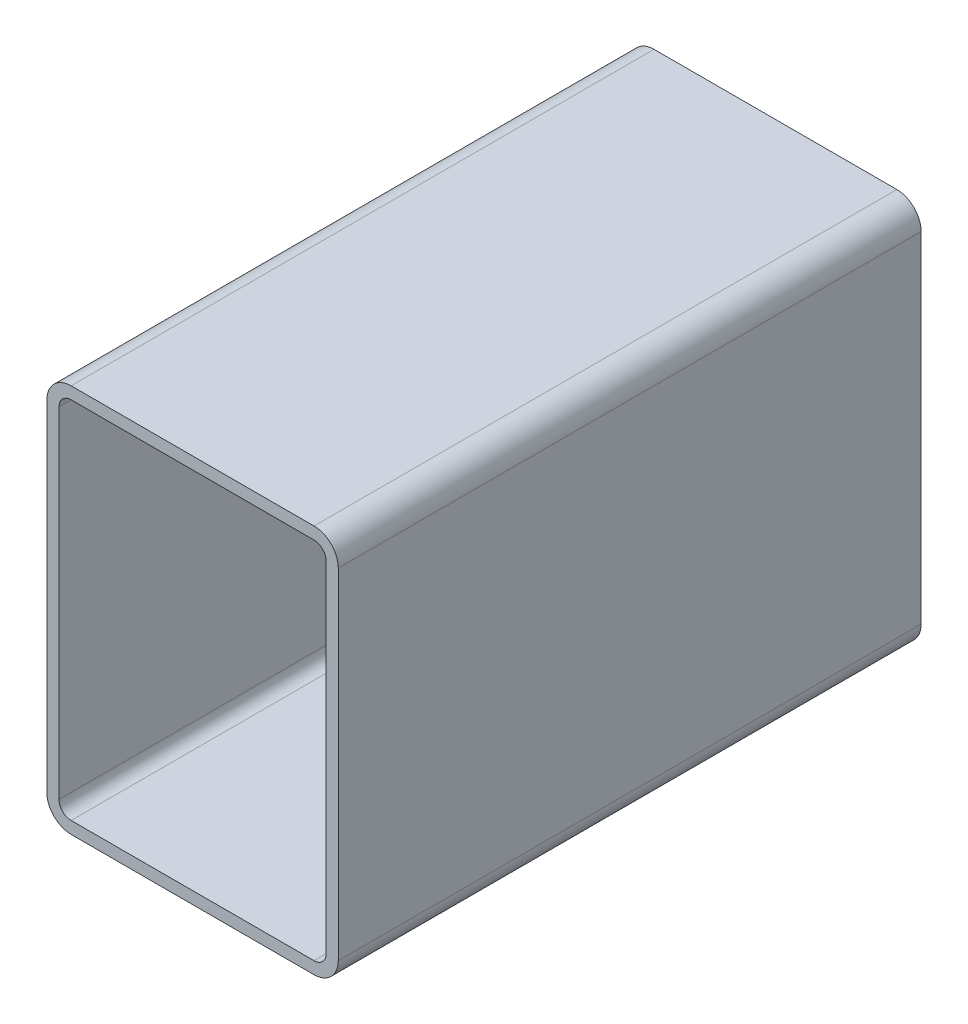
SolidWorks part; units mm, degrees
ref_plane "Front Plane" through (0, 0, 0) normal (0, 0, 1) x (1, 0, 0)
ref_plane "Top Plane" through (0, 0, 0) normal (0, 1, 0) x (1, 0, 0)
ref_plane "Right Plane" through (0, 0, 0) normal (1, 0, 0) x (0, 0, -1)
sketch "Sketch1" plane through (0, 0, 0) normal (0, 0, 1) x (1, 0, 0)
  point P0 (0, 0)
sketch_block_instance "HSS8x6x0.250-1"
sketch_block "HSS8x6x0.250"
extrude "Boss-Extrude1" add sketch "Sketch1" along normal blind 304.8
